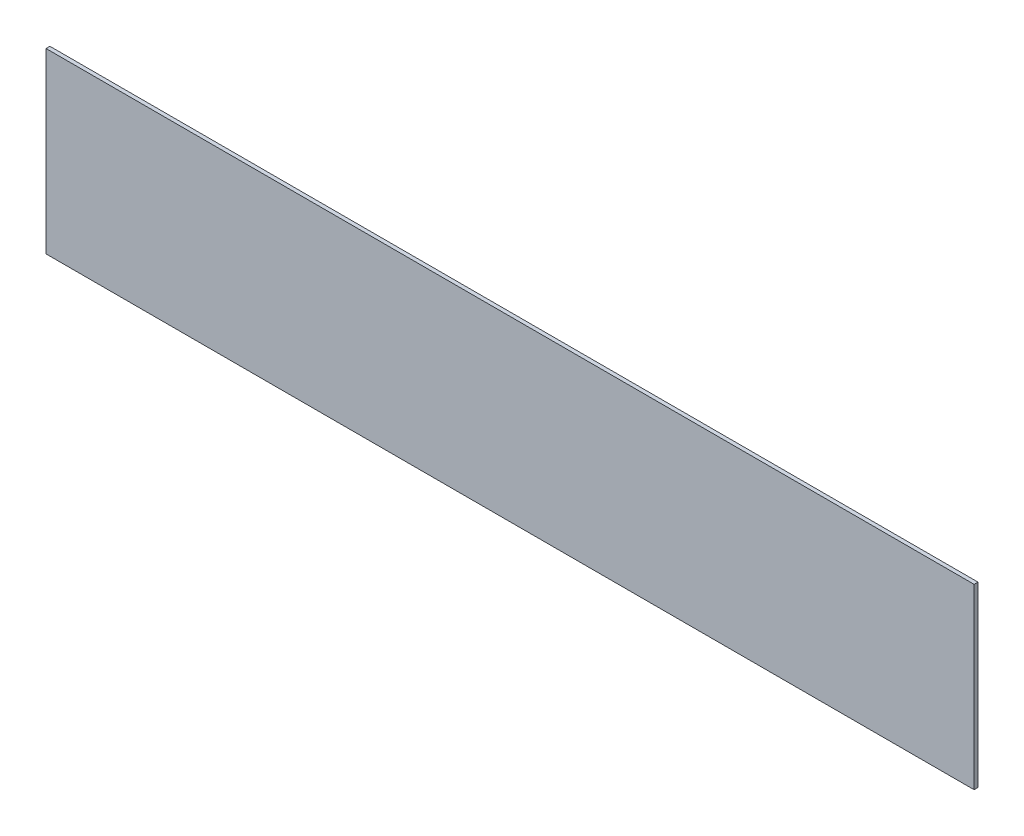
SolidWorks part; units mm, degrees
ref_plane "Plan de face" through (0, 0, 0) normal (0, 0, 1) x (1, 0, 0)
ref_plane "Plan de dessus" through (0, 0, 0) normal (0, 1, 0) x (1, 0, 0)
ref_plane "Plan de droite" through (0, 0, 0) normal (1, 0, 0) x (0, 0, -1)
ref_plane "Plan1" through (0, 0, 0) normal (0, 0, -1) x (-1, 0, 0)
sketch "Esquisse1" plane through (0, 0, 0) normal (0, 0, -1) x (-1, 0, 0)
  line L0 (-120, 0) -> (-120, -23)
  line L1 (-120, -23) -> (0, -23)
  line L2 (0, -23) -> (0, 0)
  line L3 (0, 0) -> (-120, 0)
extrude "Boss.-Extru.1" add sketch "Esquisse1" against normal blind 0.5
sketch "Esquisse2" plane through (0, 0, 0) normal (0, 0, -1) x (-1, 0, 0)
  line L0 (-110.6385, -7.8227) -> (-83.3902, -7.8227)
  line L1 (-104.4895, -18.1915) -> (-83.3902, -18.1915)
  line L2 (-66.9929, -17.1064) -> (-11.8934, -17.1064)
sketch "Esquisse3" plane through (0, 0, 0) normal (0, 0, -1) x (-1, 0, 0)
  text T0 "CHARGE" font "Arial" height in points 18
  text T1 "MAXI" font "Arial" height in points 18
  text T2 "100 Kg" font "Arial" height in points 48
extrude "Enlèv. mat.-Extru.1" cut sketch "Esquisse3" against normal blind 0.3
